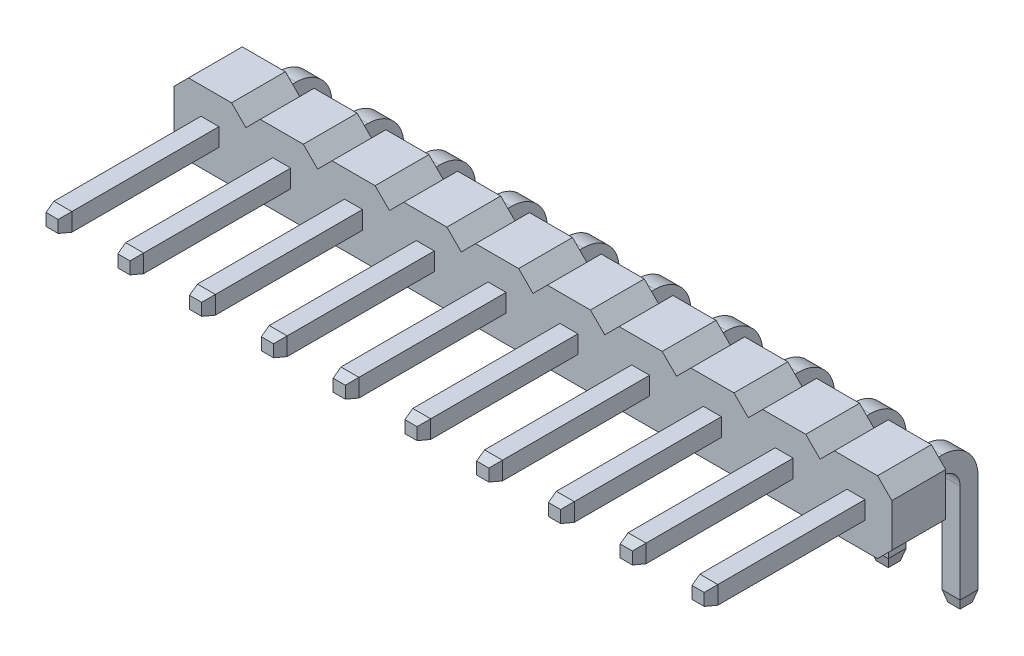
SolidWorks part; units mm, degrees
ref_plane "Front" through (0, 0, 0) normal (0, 0, 1) x (1, 0, 0)
ref_plane "Top" through (0, 0, 0) normal (0, 1, 0) x (1, 0, 0)
ref_plane "Right" through (0, 0, 0) normal (1, 0, 0) x (0, 0, -1)
sketch "Эскиз5" plane through (0, 0, 0) normal (1, 0, 0) x (0, 0, -1)
  line L0 (-0.25, -2.8) -> (-0.25, 0.25)
  line L1 (-0.75, 0.75) -> (-7.3, 0.75)
  line L2 (0.25, -2.8) -> (0.25, 0.25)
  line L3 (-0.75, 1.25) -> (-7.3, 1.25)
  line L4 (0.25, -2.8) -> (-0.25, -2.8)
  line L5 (-7.3, 0.75) -> (-7.3, 1.25)
  line L6 (0, -2.8) -> (0, 0) construction
  line L7 (-7.3, 1) -> (-6.0064, 1) construction
  arc A0 (-0.25, 0.25) -> (-0.75, 0.75) centre (-0.75, 0.25) ccw
  arc A1 (0.25, 0.25) -> (-0.75, 1.25) centre (-0.75, 0.25) ccw
  dimension "D1" = 0.5
  dimension "D3" = 0.25
  dimension "D4" = 2.8
  dimension "D5" = 7.3
  dimension "D6" = 0.75
  dimension "D2" = 0.5
extrude "Вытянуть3" add sketch "Эскиз5" along normal mid plane 0.5
ref_plane "Плоскость1" through (0, 0, 2.9) normal (0, 0, 1) x (1, 0, 0)
sketch "Эскиз3" plane through (0, 0, 2.9) normal (0, 0, 1) x (1, 0, 0)
  line L0 (-1, 1) -> (1, 1) construction
  line L1 (-0.6, 0) -> (0.6, 0)
  line L2 (-1, 0.4) -> (-1, 1.6)
  line L3 (-0.6, 2) -> (0.6, 2)
  line L4 (1, 0.4) -> (1, 1.6)
  line L5 (-1, 1.6) -> (-0.6, 2)
  line L6 (-1, 0.4) -> (-0.6, 0)
  line L7 (0.6, 0) -> (1, 0.4)
  line L8 (0.6, 2) -> (1, 1.6)
  dimension "D1" = 2
  dimension "D2" = 2
extrude "Вытянуть4" add sketch "Эскиз3" against normal blind 1.5
chamfer "Фаска1" distance 0.3 angle 15 8 edges at (0, -2.8, 0.25) (0.25, -2.8, 0) (0, -2.8, -0.25) (-0.25, -2.8, 0) (0, 1.25, 7.3) (0.25, 1, 7.3) (0, 0.75, 7.3) (-0.25, 1, 7.3)
pattern_linear "Линейный массив1" count 10 spacing 2 along (-1, 0, 0) of "Вытянуть4"
pattern_linear "Линейный массив2" count 10 spacing 2 along (-1, 0, 0) of "Вытянуть3", "Фаска1"
